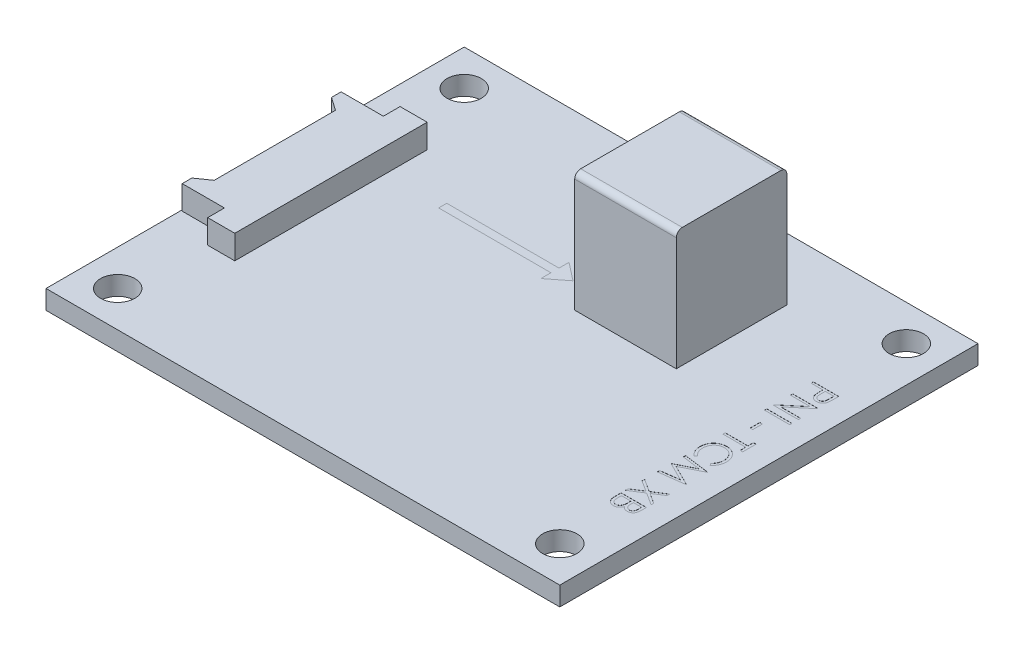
SolidWorks part; units mm, degrees
ref_plane "Front Plane" through (0, 0, 0) normal (0, 0, 1) x (1, 0, 0)
ref_plane "Top Plane" through (0, 0, 0) normal (0, 1, 0) x (1, 0, 0)
ref_plane "Right Plane" through (0, 0, 0) normal (1, 0, 0) x (0, 0, -1)
sketch "Sketch1" plane through (0, 0, 0) normal (0, 1, 0) x (1, 0, 0)
  line L0 (-21.5, 17.5) -> (21.5, -17.5) construction
  line L1 (-21.5, 17.5) -> (21.5, 17.5)
  line L2 (-21.5, 17.5) -> (-21.5, -17.5)
  line L3 (-21.5, -17.5) -> (21.5, -17.5)
  line L4 (21.5, 17.5) -> (21.5, -17.5)
  circle A0 centre (-18.5, 14.5) radius 1.435
  circle A1 centre (18.5, -14.5) radius 1.435
  circle A2 centre (-18.5, -14.5) radius 1.435
  circle A3 centre (18.5, 14.5) radius 1.435
  dimension "D3" = 2.87
  dimension "D4" = 3
  dimension "D7" = 3
  dimension "D8" = 3
  dimension "D9" = 37
  dimension "D11" = 29
  dimension "31.0" = 35
  dimension "D2" = 43
extrude "Boss-Extrude1" add sketch "Sketch1" along normal blind 1.588
sketch "Sketch7" plane through (0, 1.588, 0) normal (0, 1, 0) x (1, 0, 0)
  line L0 (6.45, 12.3) -> (6.45, 3.05) construction
  line L1 (2.2, 12.3) -> (10.7, 12.3)
  line L2 (2.2, 12.3) -> (2.2, 3.05)
  line L3 (2.2, 3.05) -> (10.7, 3.05)
  line L4 (10.7, 12.3) -> (10.7, 3.05)
  line L5 (6.45, 7.675) -> (10.7, 7.675) construction
  line L8 (21.5, -17.5) -> (21.5, 17.5) construction
  line L9 (21.5, 17.5) -> (-21.5, 17.5) construction
  dimension "D1" = 10.8
  dimension "D2" = 5.2
  dimension "D3" = 9.25
  dimension "D4" = 8.5
extrude "Boss-Extrude4" add sketch "Sketch7" along normal blind 10
fillet "Fillet1" radius 0.5 2 edges at (6.45, 11.588, -3.05) (6.45, 11.588, -12.3)
sketch "Sketch9" plane through (0, 1.588, 0) normal (0, 1, 0) x (1, 0, 0)
  line L0 (-21.5, 17.5) -> (-21.5, -17.5) construction
  line L1 (-15.6, 8.5) -> (-17.8668, 8.5)
  line L2 (-15.6, 8.5) -> (-15.6, -7.6)
  line L3 (-15.6, -7.6) -> (-17.8668, -7.6)
  line L4 (-21.4, 7.1) -> (-21.4, 6.2951)
  line L5 (21.5, 17.5) -> (-21.5, 17.5) construction
  line L6 (-17.8668, 8.5) -> (-17.8668, 7.1)
  line L7 (-17.8668, 7.1) -> (-21.4, 7.1)
  line L8 (-17.8668, -7.6) -> (-17.8668, -6.2)
  line L9 (-17.8668, -6.2) -> (-21.4, -6.2)
  line L10 (-15.6, 0.45) -> (-21.4, 0.45) construction
  line L11 (-21.4, 6.2951) -> (-20.3, 5.5242)
  line L12 (-21.4, -5.3951) -> (-20.3, -4.6242)
  line L13 (-20.3, 5.5242) -> (-20.3, -4.6242)
  line L14 (-21.4, -5.3951) -> (-21.4, -6.2)
  point P18 (-20.3, 0.45)
  dimension "D1" = 0.1
  dimension "D2" = 16.1
  dimension "D3" = 9
  dimension "D4" = 5.8
  dimension "D5" = 1.4
  dimension "D6" = 1.1
extrude "Boss-Extrude5" add sketch "Sketch9" along normal blind 2
sketch "Sketch3" plane through (0, 0, 0) normal (0, -1, 0) x (1, 0, 0)
  line L0 (15.5531, -10.2816) -> (2.4505, -10.2816)
  line L1 (2.4505, -10.2816) -> (2.4505, -9.8892)
  line L2 (2.4505, -9.8892) -> (-3.2378, -9.8892)
  line L3 (-3.2378, -9.8892) -> (-3.2378, -10.5465)
  line L4 (-3.2378, -10.5465) -> (-15.5422, -10.5465)
  line L5 (-15.5422, -10.5465) -> (-15.5422, 7.3136)
  line L6 (-15.5422, 7.3136) -> (-3.0581, 7.3136)
  line L7 (-3.0581, 7.3136) -> (-3.0581, 14.8237)
  line L8 (-3.0581, 14.8237) -> (4.8087, 14.8237)
  line L9 (4.8087, 14.8237) -> (4.8087, 10.3697)
  line L10 (4.8087, 10.3697) -> (15.5531, 10.3697)
  line L11 (15.5531, 10.3697) -> (15.5531, -10.2816)
sketch "Sketch4" plane through (0, 0, 0) normal (0, 1, 0) x (1, 0, 0)
  line L0 (21.5, -17.5) -> (21.5, 17.5) construction
  line L5 (-21.5, 17.5) -> (-21.5, -17.5)
  line L6 (-21.5, -17.5) -> (21.5, -17.5)
  line L7 (21.5, -17.5) -> (21.5, 17.5)
  line L8 (21.5, 17.5) -> (-21.5, 17.5)
  line L9 (-21.5, 17.5) -> (-21.5, -17.5)
  line L10 (-21.5, -17.5) -> (21.5, -17.5)
  line L11 (21.5, -17.5) -> (21.5, 17.5)
  line L12 (21.5, 17.5) -> (-21.5, 17.5)
  point P0 (18.5, -14.5)
  point P1 (-18.5, -14.5)
  point P3 (-18.5, 14.5)
  dimension "D1" = 3
  dimension "D2" = 37
  dimension "D3" = 40
  dimension "D4" = 29
  dimension "D5" = 0
sketch "Sketch6" plane through (0, 1.588, 0) normal (0, 1, 0) x (1, 0, 0)
  line L0 (-1.5085, 5.1049) -> (0, 5.1049) construction
  line L1 (-10.9054, 5.4423) -> (-1.5085, 5.4423)
  line L2 (-10.9054, 5.4423) -> (-10.9054, 4.7675)
  line L3 (-10.9054, 4.7675) -> (-1.5085, 4.7675)
  line L4 (-1.5085, 5.4423) -> (-1.5085, 4.7675) construction
  line L5 (0, 5.1049) -> (-1.5085, 6.2824)
  line L6 (0, 5.1049) -> (-1.5085, 3.9274)
  line L7 (-1.5085, 3.9274) -> (-1.5085, 4.7675)
  line L8 (-1.5085, 6.2824) -> (-1.5085, 5.4423)
sketch "Sketch8" plane through (0, 1.588, 0) normal (0, 1, 0) x (1, 0, 0)
  line L0 (17.3807, 8.1144) -> (17.3807, -8.031) construction
  text T0 "PNI - TCM XB" font "Century Gothic" height in points 8
extrude "Cut-Extrude2" cut sketch "Sketch8" against normal blind 0.01
equation "\"Buoyancy\"=\"SW-Volume\"*(\"SW-Density\"-.037062)"
